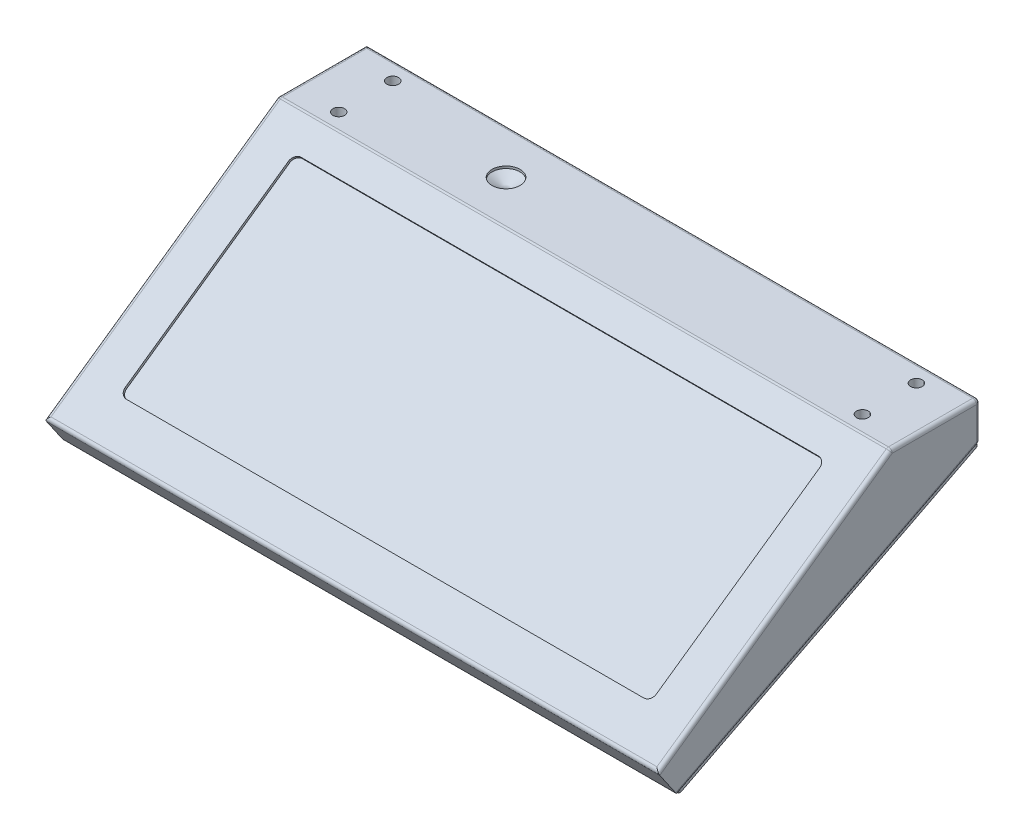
SolidWorks part; units mm, degrees
ref_plane "Front Plane" through (0, 0, 0) normal (0, 0, 1) x (1, 0, 0)
ref_plane "Top Plane" through (0, 0, 0) normal (0, 1, 0) x (1, 0, 0)
ref_plane "Right Plane" through (0, 0, 0) normal (1, 0, 0) x (0, 0, -1)
sketch "Sketch2" plane through (0, 0, 0) normal (1, 0, 0) x (0, 0, -1)
  line L0 (0, 0) -> (-60.579, 0)
  line L1 (-60.579, 0) -> (-219.041, -110.9563)
  line L2 (-219.041, -110.9563) -> (-205.3373, -130.7866)
  line L3 (0, 0) -> (0, -26.162)
  line L4 (0, -26.162) -> (-205.3373, -130.7866)
  dimension "D1" = 60.579
  dimension "D2" = 193.4464
  dimension "D3" = 24.1046
  dimension "D4" = 26.162
  dimension "D5" = 145
  dimension "D6" = 117
extrude "Enclosure Body" add sketch "Sketch2" along normal mid plane 416.56
fillet "Radii" radius 2.54 12 edges at (0, 0, 60.579) (208.28, -55.4781, 139.81) (0, -110.9563, 219.041) (-208.28, -55.4781, 139.81) (-208.28, 0, 30.2895) (0, 0, 0) (208.28, -13.081, 0) (208.28, 0, 30.2895) (-208.28, -78.4743, 102.6687) (0, -130.7866, 205.3373) (208.28, -78.4743, 102.6687) (0, -26.162, 0)
sketch "Sketch3" plane through (0, 28.4628, 19.9299) normal (0, 0.8192, 0.5736) x (1, 0, 0)
  line L0 (208.28, -243.0854) -> (-208.28, -243.0854) construction
  line L1 (-175.5648, -69.959) -> (175.5648, -69.959)
  line L2 (-180.34, -74.7342) -> (-180.34, -209.9638)
  line L3 (-175.5648, -214.739) -> (175.5648, -214.739)
  line L4 (180.34, -74.7342) -> (180.34, -209.9638)
  arc A0 (-180.34, -209.9638) -> (-175.5648, -214.739) centre (-175.5648, -209.9638) ccw
  arc A1 (175.5648, -214.739) -> (180.34, -209.9638) centre (175.5648, -209.9638) ccw
  arc A2 (175.5648, -69.959) -> (180.34, -74.7342) centre (175.5648, -74.7342) cw
  arc A3 (-175.5648, -69.959) -> (-180.34, -74.7342) centre (-175.5648, -74.7342) ccw
  point P4 (0, -69.959)
  point P10 (-180.34, -214.739)
  point P13 (180.34, -214.739)
  point P18 (-180.34, -69.959)
  dimension "D4" = 4.7752
  dimension "D1" = 360.68
  dimension "D2" = 144.78
  dimension "D3" = 28.3464
extrude "Keys Extrude" cut sketch "Sketch3" against normal blind 1.6002
sketch "Sketch4" plane through (0, -20.7698, -10.5828) normal (0, -0.891, -0.454) x (1, 0, 0)
  line L0 (205.74, 240.111) -> (-205.74, 240.111) construction
  line L1 (-205.232, 240.6109) -> (205.232, 240.6109)
  line L2 (-206.756, 239.0869) -> (-206.756, 14.1699)
  line L3 (-205.232, 12.6459) -> (205.232, 12.6459)
  line L4 (206.756, 239.0869) -> (206.756, 14.1699)
  line L5 (-208.28, 10.5831) -> (-208.28, 242.6738) construction
  arc A0 (-206.756, 14.1699) -> (-205.232, 12.6459) centre (-205.232, 14.1699) ccw
  arc A1 (205.232, 12.6459) -> (206.756, 14.1699) centre (205.232, 14.1699) ccw
  arc A2 (205.232, 240.6109) -> (206.756, 239.0869) centre (205.232, 239.0869) cw
  arc A3 (-205.232, 240.6109) -> (-206.756, 239.0869) centre (-205.232, 239.0869) ccw
  point P6 (-206.756, 12.6459)
  point P11 (206.756, 240.6109)
  point P14 (-206.756, 240.6109)
  point P15 (0, 240.6109)
  point P18 (0, 240.111)
  point P19 (-206.756, 126.6284)
  point P22 (-208.28, 126.6284)
  dimension "D3" = 1.524
  dimension "D1" = 227.965
  dimension "D2" = 413.512
extrude "Sub-panel Emboss" add sketch "Sketch4" along normal blind 2.286
hole_wizard "Mounting Holes" positions "Sketch5" profile "Sketch6" hole size "5/16" standard "ANSI Inch"
sketch "Sketch5" plane through (0, 0, 0) normal (0, 1, 0) x (1, 0, 0)
  line L0 (-177.8, -12.8203) -> (177.8, -12.8203) construction
  line L2 (-177.8, -12.8203) -> (-177.8, -49.4979) construction
  line L4 (-205.74, -2.54) -> (-205.74, -59.7781) construction
  point P0 (-177.8, -12.8203)
  point P2 (-177.8, -49.4979)
  point P4 (177.8, -49.4979)
  point P6 (177.8, -12.8203)
  point P18 (0, -12.8203)
  point P25 (-177.8, -31.1591)
  point P28 (-205.74, -31.1591)
  dimension "D1" = 355.6
  dimension "D2" = 36.6776
sketch "Sketch6" plane through (-177.8, 0, 12.8203) normal (1, 0, 0) x (0, 0, 1)
  line L0 (0, 0) -> (0, 132.0417)
  line L1 (0, 132.0417) -> (3.9687, 132.0417)
  line L2 (3.9687, 132.0417) -> (3.9687, 0)
  line L5 (3.9687, 0) -> (0, 0)
  line L11 (0, -6.35) -> (0, 107.95) construction
  dimension "Thru Hole Dia." = 7.9375
  dimension "Thru Hole Depth" = 132.0417
hole_wizard "Cable Access Hole" positions "Sketch7" profile "Sketch8" hole size "3/4" standard "ANSI Inch"
sketch "Sketch7" plane through (0, 0, 0) normal (0, 1, 0) x (1, 0, 0)
  line L0 (-177.8, -12.8203) -> (-177.8, -49.4979) construction
  point P0 (-82.55, -31.1591)
  point P9 (-177.8, -31.1591)
  dimension "D1" = 95.25
sketch "Sketch8" plane through (-82.55, 0, 31.1591) normal (1, 0, 0) x (0, 0, 1)
  line L0 (0, 0) -> (0, 7.2472)
  line L1 (0, 7.2472) -> (9.525, 1.524)
  line L2 (9.525, 1.524) -> (9.525, 0)
  line L5 (9.525, 0) -> (0, 0)
  line L10 (0, 7.2472) -> (-9.525, 1.524) construction
  line L11 (0, -6.35) -> (0, 107.95) construction
  dimension "Hole Dia." = 19.05
  dimension "Hole Depth" = 1.524
  dimension "Drill Angle" = 118
